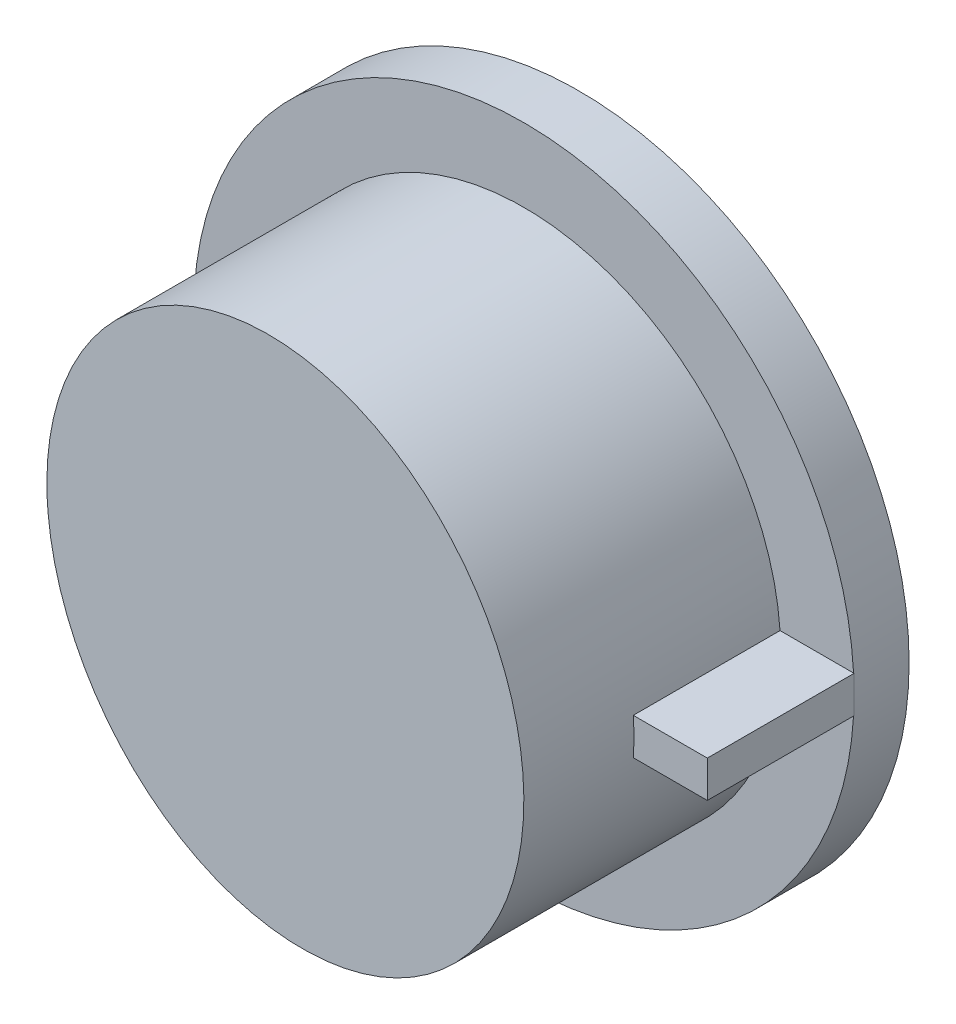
SolidWorks part; units mm, degrees
ref_plane "Face" through (0, 0, 0) normal (0, 0, 1) x (1, 0, 0)
ref_plane "Dessus" through (0, 0, 0) normal (0, 1, 0) x (1, 0, 0)
ref_plane "Droite" through (0, 0, 0) normal (1, 0, 0) x (0, 0, -1)
sketch "Esquisse1" plane through (0, 0, 0) normal (0, 0, 1) x (1, 0, 0)
  circle A0 centre (0, 0) radius 9
  dimension "D1" = 18
extrude "Extrusion1" add sketch "Esquisse1" along normal blind 1.5
sketch "Esquisse2" plane through (0, 0, 1.5) normal (0, 0, 1) x (1, 0, 0)
  circle A0 centre (0, 0) radius 7
  dimension "D1" = 14
extrude "Extrusion2" add sketch "Esquisse2" along normal blind 8
sketch "Esquisse3" plane through (0, 0, 0) normal (0, 1, 0) x (1, 0, 0)
  line L0 (-7, -7.5) -> (7, -8.5)
  line L1 (7, -8.5) -> (7, -11.847)
  line L2 (7, -11.847) -> (-7, -11.847)
  line L3 (-7, -11.847) -> (-7, -7.5)
  line L5 (-7, -1.5) -> (-7, -9.5) construction
  line L6 (7, -9.5) -> (7, -1.5) construction
  dimension "D1" = 6
  dimension "D2" = 7
extrude "Enlèv. mat.-Extru.1" cut sketch "Esquisse3" against normal mid plane 18
sketch "Esquisse4" plane through (0, 0, 0) normal (0, 0, -1) x (-1, 0, 0)
  circle A0 centre (0, 0) radius 6
  dimension "D1" = 12
extrude "Enlèv. mat.-Extru.2" cut sketch "Esquisse4" against normal blind 6
sketch "Esquisse5" plane through (0, 0, 0) normal (0, 1, 0) x (1, 0, 0)
  line L0 (6.3846, -1.5) -> (9, -1.5)
  line L1 (-9, -1.5) -> (9, -1.5) construction
  line L2 (9, -1.5) -> (9, -5.5)
  line L3 (9, -5.5) -> (6.3846, -5.5)
  line L4 (6.3846, -5.5) -> (6.3846, -1.5)
  dimension "D1" = 4
extrude "Extrusion3" add sketch "Esquisse5" along normal mid plane 1
